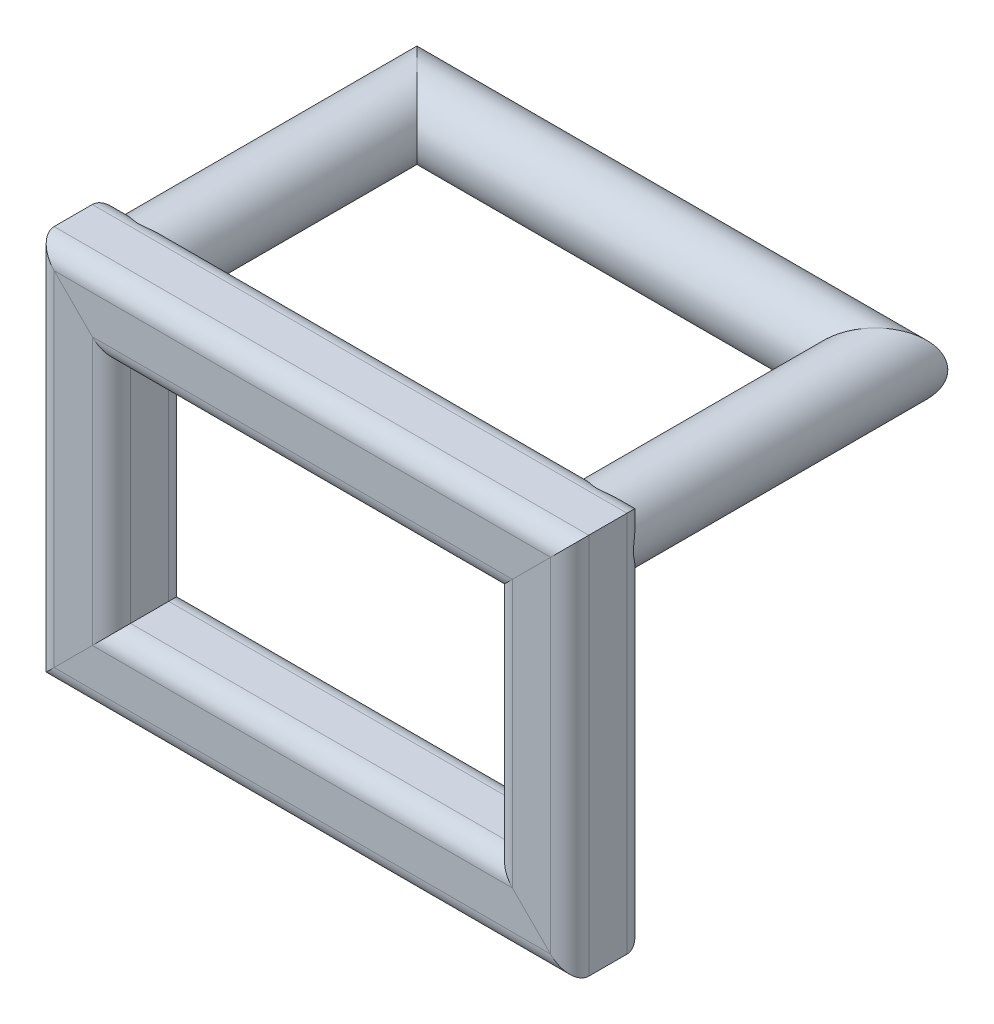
SolidWorks part; units mm, degrees
ref_plane "Front Plane" through (0, 0, 0) normal (0, 0, 1) x (1, 0, 0)
ref_plane "Top Plane" through (0, 0, 0) normal (0, 1, 0) x (1, 0, 0)
ref_plane "Right Plane" through (0, 0, 0) normal (1, 0, 0) x (0, 0, -1)
sketch "Sketch1" plane through (0, 0, 0) normal (0, 0, 1) x (1, 0, 0)
  line L1 (0, 0) -> (304.8, 0)
  line L2 (0, 0) -> (0, -203.2)
  line L3 (0, -203.2) -> (304.8, -203.2)
  line L4 (304.8, 0) -> (304.8, -203.2)
  dimension "D1" = 304.8
  dimension "D2" = 203.2
sketch "Sketch2" plane through (0, 0, 0) normal (0, 1, 0) x (1, 0, 0)
  line L0 (0, 0) -> (0, 203.2)
  line L1 (0, 203.2) -> (304.8, 203.2)
  line L2 (304.8, 203.2) -> (304.8, 0)
  line L3 (0, 0) -> (304.8, 0) construction
  dimension "D1" = 304.8
  dimension "D2" = 203.2
other "Structural Member1"
ref_plane "Plane1" through (304.8, 0, 0) normal (0, -1, 0) x (1, 0, 0)
sketch "Sketch11" plane through (304.8, 0, 0) normal (0, -1, 0) x (1, 0, 0)
  line L0 (-12.7, -19.05) -> (12.7, -19.05)
  line L1 (-19.05, -12.7) -> (-19.05, 12.7)
  line L2 (12.7, 19.05) -> (-12.7, 19.05)
  line L3 (19.05, 12.7) -> (19.05, -12.7)
  line L4 (-12.7, -25.4) -> (12.7, -25.4)
  line L5 (-25.4, -12.7) -> (-25.4, 12.7)
  line L6 (12.7, 25.4) -> (-12.7, 25.4)
  line L7 (25.4, 12.7) -> (25.4, -12.7)
  line L8 (0, 0) -> (19.05, 0) construction
  line L9 (0, 0) -> (0, 19.05) construction
  arc A0 (25.4, 12.7) -> (12.7, 25.4) centre (12.7, 12.7) ccw
  arc A1 (12.7, -25.4) -> (25.4, -12.7) centre (12.7, -12.7) ccw
  arc A2 (-25.4, -12.7) -> (-12.7, -25.4) centre (-12.7, -12.7) ccw
  arc A3 (-12.7, 25.4) -> (-25.4, 12.7) centre (-12.7, 12.7) ccw
  arc A4 (-12.7, 19.05) -> (-19.05, 12.7) centre (-12.7, 12.7) ccw
  arc A5 (19.05, 12.7) -> (12.7, 19.05) centre (12.7, 12.7) ccw
  arc A6 (12.7, -19.05) -> (19.05, -12.7) centre (12.7, -12.7) ccw
  arc A7 (-19.05, -12.7) -> (-12.7, -19.05) centre (-12.7, -12.7) ccw
  point P3 (0, 25.4)
  point P4 (25.4, 0)
  point P5 (0, -25.4)
  point P6 (-25.4, 0)
  point P7 (-25.4, 25.4)
  point P8 (-25.4, -25.4)
  point P33 (0, 0)
  point P35 (25.4, -25.4)
  point P36 (25.4, 25.4)
  point P37 (0, 0)
  dimension "D1" = 12.7
  dimension "Thickness" = 6.35
  dimension "V_leg" = 50.8
other "Structural Member2"
ref_plane "Plane2" through (304.8, 0, -203.2) normal (0, 0, 1) x (1, 0, 0)
sketch "Sketch14" plane through (304.8, 0, -203.2) normal (0, 0, 1) x (1, 0, 0)
  circle A0 centre (0, 0) radius 20.447
  circle A1 centre (0, 0) radius 24.13
  circle A2 centre (0, 0) radius 19.05 construction
  point P5 (0, 0)
  dimension "In_dia" = 40.894
  dimension "Out_dia" = 48.26
  dimension "D1" = 38.1
other "Trim/Extend1"
